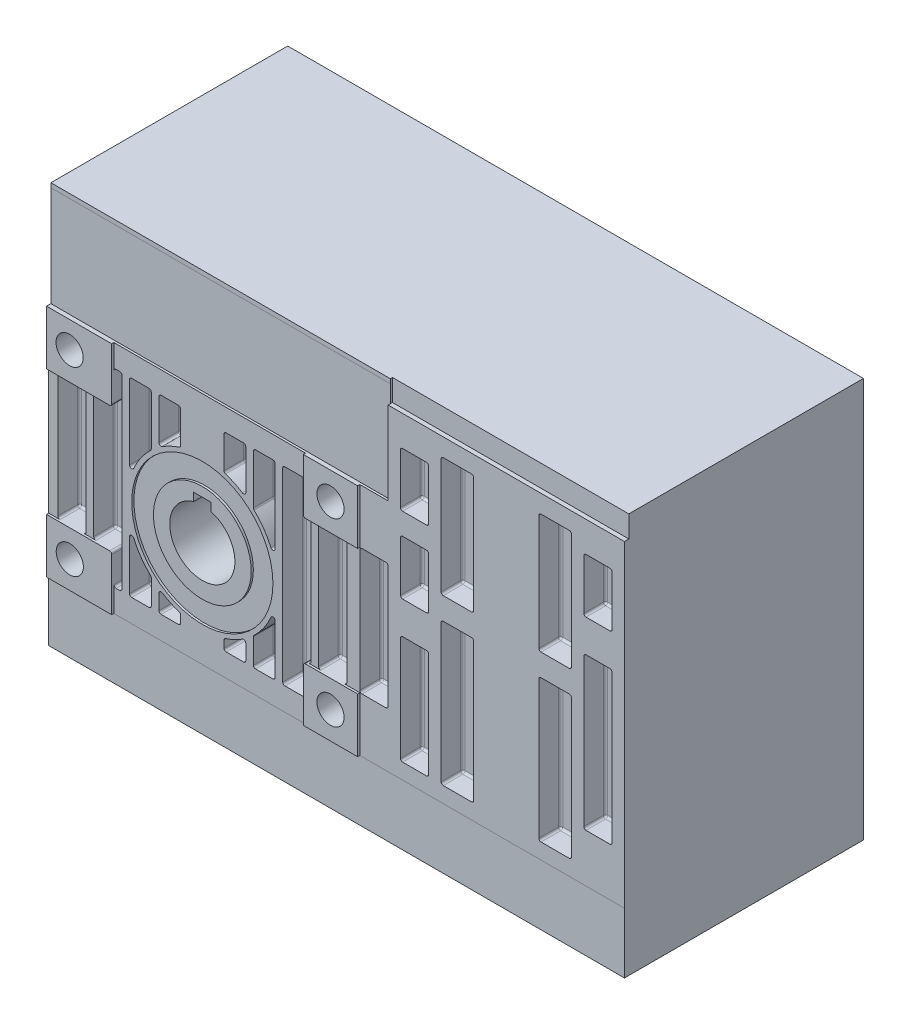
SolidWorks part; units mm, degrees
ref_plane "Plan de face" through (0, 0, 0) normal (0, 0, 1) x (1, 0, 0)
ref_plane "Plan de dessus" through (0, 0, 0) normal (0, 1, 0) x (1, 0, 0)
ref_plane "Plan de droite" through (0, 0, 0) normal (1, 0, 0) x (0, 0, -1)
sketch "Esquisse1" plane through (0, 0, 0) normal (0, 0, 1) x (1, 0, 0)
  line L0 (-132.5, 92) -> (132.5, -92) construction
  line L1 (-132.5, 92) -> (132.5, 92)
  line L2 (-132.5, 92) -> (-132.5, -92)
  line L3 (-132.5, -92) -> (132.5, -92)
  line L4 (132.5, 92) -> (132.5, -92)
  dimension "D1" = 265
  dimension "D2" = 184
extrude "Extrusion1" add sketch "Esquisse1" along normal mid plane 110
sketch "Esquisse2" plane through (0, 0, 0) normal (0, 0, 1) x (1, 0, 0)
  line L0 (-132.5, -92) -> (132.5, -92) construction
  line L1 (-132.5, 92) -> (-132.5, -92) construction
  line L2 (-61.8, -36.8193) -> (-61.8, 14.4551) construction
  line L3 (-65.8, 2.5) -> (-57.8, 2.5)
  line L4 (-65.8, 2.5) -> (-65.8, -1.2432)
  line L6 (-57.8, 2.5) -> (-57.8, -1.2432)
  arc A0 (-65.8, -1.2432) -> (-57.8, -1.2432) centre (-61.8, -15.7) ccw
  dimension "D3" = 30
  dimension "D1" = 76.3
  dimension "D2" = 70.7
  dimension "D4" = 8
  dimension "D5" = 18.2
extrude "Enlèv. mat.-Extru.1" cut sketch "Esquisse2" against normal mid plane 110
sketch "Esquisse3" plane through (0, 0, 55) normal (0, 0, 1) x (1, 0, 0)
  line L0 (-61.8, -48.9025) -> (-61.8, 32.4301) construction
  line L1 (-31.9153, -15.7) -> (-94.3732, -15.7) construction
  line L2 (-61.8, -36.8193) -> (-61.8, 14.4551) construction
  arc A0 (-65.8, -1.2432) -> (-57.8, -1.2432) centre (-61.8, -15.7) ccw construction
  point P0 (-121.8, 31.3)
  point P6 (-1.8, 31.3)
  point P9 (-121.8, -51.7)
  point P10 (-1.8, -51.7)
  dimension "D2" = 47
  dimension "D3" = 83
  dimension "D1" = 60
  dimension "D4" = 60
sketch "Esquisse5" plane through (0, 0, 55) normal (0, 0, 1) x (1, 0, 0)
  line L0 (-14.3, 43.8) -> (10.7, 18.8) construction
  line L1 (-14.3, 43.8) -> (10.7, 43.8)
  line L2 (-14.3, 43.8) -> (-14.3, 18.8)
  line L3 (-14.3, 18.8) -> (10.7, 18.8)
  line L4 (10.7, 43.8) -> (10.7, 18.8)
  line L5 (-106.3299, -51.7) -> (-137.2701, -51.7) construction
  line L6 (-14.3, -39.2) -> (10.7, -64.2) construction
  line L7 (-14.3, -39.2) -> (10.7, -39.2)
  line L8 (-14.3, -39.2) -> (-14.3, -64.2)
  line L9 (-14.3, -64.2) -> (10.7, -64.2)
  line L10 (10.7, -39.2) -> (10.7, -64.2)
  line L11 (-106.3299, 31.3) -> (-137.2701, 31.3) construction
  line L12 (-132.5, 43.8) -> (-102.5, 43.8)
  line L13 (-132.5, 43.8) -> (-132.5, 18.8)
  line L14 (-132.5, 18.8) -> (-102.5, 18.8)
  line L15 (-102.5, 43.8) -> (-102.5, 18.8)
  line L16 (-132.5, 92) -> (-132.5, -92) construction
  line L18 (-132.5, -64.2) -> (-102.5, -64.2)
  line L19 (-132.5, -64.2) -> (-132.5, -39.2)
  line L20 (-132.5, -39.2) -> (-102.5, -39.2)
  line L21 (-102.5, -64.2) -> (-102.5, -39.2)
  dimension "D1" = 25
  dimension "D2" = 25
  dimension "D3" = 25
  dimension "D4" = 25
  dimension "D5" = 30
  dimension "D6" = 25
  dimension "D7" = 25
  dimension "D8" = 30
extrude "Extrusion2" add sketch "Esquisse5" along normal blind 1
hole_wizard "Trou taraudé M14x1.57" positions "Esquisse11" profile "Esquisse10" tap size "M14x1.5" standard "ISO"
sketch "Esquisse11" plane through (0, 0, 56) normal (0, 0, 1) x (1, 0, 0)
  point P1 (-121.8821, 31.6362)
  point P5 (-1.8, 31.3)
  point P8 (-1.8, -51.7)
  point P11 (-121.8, -51.7)
sketch "Esquisse10" plane through (-121.8821, 31.6362, 56) normal (1, 0, 0) x (0, -1, 0)
  line L0 (0, 0) -> (0, 26.2554)
  line L1 (0, 26.2554) -> (6.25, 22.5)
  line L2 (6.25, 22.5) -> (6.25, 0)
  line L5 (6.25, 0) -> (0, 0)
  line L10 (0, 26.2554) -> (-6.25, 22.5) construction
  line L11 (0, -6.35) -> (0, 107.95) construction
  dimension "Diamètre du trou pour taraudage" = 12.5
  dimension "Profondeur du trou pour taraudage" = 22.5
  dimension "Angle de pointe" = 118
sketch "Esquisse12" plane through (0, 0, 55) normal (0, 0, 1) x (1, 0, 0)
  circle A0 centre (-61.8, -15.7) radius 32.5
  circle A1 centre (-61.8, -15.7) radius 22.5
  dimension "D1" = 45
  dimension "D2" = 65
extrude "Enlèv. mat.-Extru.2" cut sketch "Esquisse12" against normal blind 1
sketch "Esquisse13" plane through (0, 0, 55) normal (0, 0, 1) x (1, 0, 0)
  line L0 (-103.9821, -15.7) -> (-20.5905, -15.7) construction
  line L1 (-81.8, 33.6362) -> (-71.8, 33.6362)
  line L2 (-81.8, 33.6362) -> (-81.8, 12.4114)
  line L3 (-95.3, 33.6362) -> (-85.3, 33.6362)
  line L4 (-71.8, 33.6362) -> (-71.8, 17.3189)
  line L5 (-85.3, 33.6362) -> (-85.3, 9.5587)
  line L6 (-71.8, -53.7) -> (-71.8, -48.7189)
  line L7 (-95.3, 33.6362) -> (-95.3, -7.4538)
  line L8 (-95.3, -53.7) -> (-85.3, -53.7)
  line L9 (-81.8, -53.7) -> (-81.8, -43.8114)
  line L10 (-85.3, -53.7) -> (-85.3, -40.9587)
  line L11 (-81.8, -53.7) -> (-71.8, -53.7)
  line L12 (-95.3, -53.7) -> (-95.3, -23.9462)
  line L13 (10.7, -39.2) -> (23.7, -39.2)
  line L14 (-61.8, -15.7) -> (-61.8, 40.066) construction
  line L15 (-8.3, -39.2) -> (4.7, -39.2)
  line L16 (-28.3, -53.7) -> (-28.3, -23.9462)
  line L17 (-51.8, -53.7) -> (-41.8, -53.7)
  line L18 (-38.3, -53.7) -> (-38.3, -40.9587)
  line L19 (-41.8, -53.7) -> (-41.8, -43.8114)
  line L20 (-38.3, -53.7) -> (-28.3, -53.7)
  line L21 (-28.3, 33.6362) -> (-28.3, -7.4538)
  line L22 (-51.8, -53.7) -> (-51.8, -48.7189)
  line L23 (-38.3, 33.6362) -> (-38.3, 9.5587)
  line L24 (-51.8, 33.6362) -> (-51.8, 17.3189)
  line L25 (-38.3, 33.6362) -> (-28.3, 33.6362)
  line L26 (-41.8, 33.6362) -> (-41.8, 12.4114)
  line L27 (-51.8, 33.6362) -> (-41.8, 33.6362)
  line L28 (10.7, 18.8) -> (23.7, 18.8)
  line L29 (-102.5, 33.6362) -> (-98.8, 33.6362)
  line L30 (-98.8, 33.6362) -> (-98.8, -53.7)
  line L31 (-102.5, -53.7) -> (-98.8, -53.7)
  line L32 (-111.8, 18.8) -> (-111.8, -39.2)
  line L33 (-128.3, 18.8) -> (-128.3, -39.2)
  line L34 (-8.3, 18.8) -> (4.7, 18.8)
  line L35 (-128.3, 18.8) -> (-115.3, 18.8)
  line L36 (-128.3, -39.2) -> (-115.3, -39.2)
  line L37 (-111.8, -39.2) -> (-102.5, -39.2)
  line L38 (-14.3, -39.2) -> (-11.8, -39.2)
  line L39 (-102.5, -53.7) -> (-102.5, -39.2)
  line L40 (-24.8, 33.6362) -> (-14.3, 33.6362)
  line L41 (-111.8, 18.8) -> (-102.5, 18.8)
  line L42 (-14.3, 33.6362) -> (-14.3, 18.8)
  line L43 (-14.3, -53.7) -> (-14.3, -39.2)
  line L44 (-115.3, 18.8) -> (-115.3, -39.2)
  line L45 (-24.8, 33.6362) -> (-24.8, -53.7)
  line L46 (-24.8, -53.7) -> (-14.3, -53.7)
  line L47 (-11.8, 18.8) -> (-11.8, -39.2)
  line L48 (-102.5, 18.8) -> (-102.5, 33.6362)
  line L49 (-8.3, 18.8) -> (-8.3, -39.2)
  line L50 (-14.3, 18.8) -> (-11.8, 18.8)
  line L51 (4.7, 18.8) -> (4.7, -39.2)
  line L52 (48.1, 73.7167) -> (63.1, 73.7167)
  line L53 (48.1, -57) -> (48.1, 8.5025)
  line L54 (48.1, 18.7167) -> (63.1, 18.7167)
  line L55 (48.1, 8.5025) -> (63.1, 8.5025)
  line L56 (63.1, 8.5025) -> (63.1, -57)
  line L57 (29.4, 8) -> (42.4, 8)
  line L59 (29.4, -57) -> (42.4, -57)
  line L60 (48.1, -57) -> (63.1, -57)
  line L61 (78.1, 107.9884) -> (78.1, -114.435) construction
  line L62 (93.1, -57) -> (93.1, 8.5025)
  line L63 (10.7, 18.8) -> (10.7, -39.2)
  line L64 (108.1, -57) -> (108.1, 8.5025)
  line L65 (23.7, 18.8) -> (23.7, -39.2)
  line L66 (132.5, -92) -> (132.5, 92) construction
  line L68 (42.4, -57) -> (42.4, -7)
  line L69 (48.1, 73.7167) -> (48.1, 18.7167)
  line L70 (42.4, 8) -> (42.4, 33)
  line L71 (63.1, 73.7167) -> (63.1, 18.7167)
  line L72 (-132.5, -92) -> (132.5, -92) construction
  line L73 (29.4, -57) -> (29.4, -7)
  line L74 (29.4, 8) -> (29.4, 33)
  line L75 (113.8, -42) -> (113.8, 28)
  line L76 (126.8, -42) -> (126.8, 28)
  line L77 (108.1, -57) -> (93.1, -57)
  line L80 (108.1, 8.5025) -> (93.1, 8.5025)
  line L81 (108.1, 18.7167) -> (93.1, 18.7167)
  line L82 (93.1, 73.7167) -> (93.1, 18.7167)
  line L83 (108.1, 73.7167) -> (108.1, 18.7167)
  line L84 (108.1, 73.7167) -> (93.1, 73.7167)
  line L88 (42.4, -7) -> (29.4, -7)
  line L92 (42.4, 33) -> (29.4, 33)
  line L94 (29.4, 43) -> (42.4, 43)
  line L95 (29.4, 43) -> (29.4, 68)
  line L96 (29.4, 68) -> (42.4, 68)
  line L97 (42.4, 43) -> (42.4, 68)
  line L98 (113.8, 28) -> (126.8, 28)
  line L100 (113.8, -42) -> (126.8, -42)
  line L102 (126.8, 68) -> (113.8, 68)
  line L103 (126.8, 68) -> (126.8, 43)
  line L104 (126.8, 43) -> (113.8, 43)
  line L105 (113.8, 68) -> (113.8, 43)
  arc A0 (-71.8, 17.3189) -> (-81.8, 12.4114) centre (-61.8, -15.7) ccw
  arc A1 (-28.3, -7.4538) -> (-38.3, 9.5587) centre (-61.8, -15.7) ccw
  circle A2 centre (-61.8, -15.7) radius 34.5
  arc A3 (-85.3, 9.5587) -> (-95.3, -7.4538) centre (-61.8, -15.7) ccw
  arc A4 (-81.8, -43.8114) -> (-71.8, -48.7189) centre (-61.8, -15.7) ccw
  arc A5 (-51.8, -48.7189) -> (-41.8, -43.8114) centre (-61.8, -15.7) ccw
  arc A6 (-38.3, -40.9587) -> (-28.3, -23.9462) centre (-61.8, -15.7) ccw
  arc A7 (-41.8, 12.4114) -> (-51.8, 17.3189) centre (-61.8, -15.7) ccw
  arc A8 (-95.3, -23.9462) -> (-85.3, -40.9587) centre (-61.8, -15.7) ccw
  dimension "D7" = 50
  dimension "D2" = 10
  dimension "D4" = 10
  dimension "D5" = 10
  dimension "D6" = 3.5
  dimension "D8" = 15
  dimension "D10" = 13
  dimension "D11" = 3.5
  dimension "D12" = 3.5
  dimension "D14" = 13
  dimension "D15" = 13
  dimension "D16" = 3.5
  dimension "D17" = 3.5
  dimension "D18" = 13
  dimension "D20" = 15
  dimension "D22" = 15
  dimension "D23" = 55
  dimension "D24" = 13
  dimension "D28" = 10
  dimension "D29" = 25
  dimension "D30" = 25
  dimension "D31" = 13
  dimension "D33" = 50
  dimension "D34" = 70
  dimension "D35" = 25
  dimension "D36" = 13
  dimension "D37" = 5.7
  dimension "D38" = 15
  dimension "D1" = 2
extrude "Enlèv. mat.-Extru.3" cut sketch "Esquisse13" against normal blind 10
fillet "Congé1" radius 1 54 edges at (-76.9994, -46.6714, 45) (-81.8, -53.7, 50) (-71.8, -48.7189, 50) (-81.8, -43.8114, 50) (-81.8, -48.7557, 45) (-71.8, -53.7, 50) (-76.8, -53.7, 45) (-71.8, -51.2095, 45) (-85.3, -53.7, 50) (-90.3, -53.7, 45) (-95.3, -53.7, 50) (-85.3, -47.3293, 45) (-85.3, -40.9587, 50) (-95.3, -38.8231, 45) (-91.5423, -33.1827, 45) (-95.3, -23.9462, 50) (-71.8, 17.3189, 50) (-81.8, 33.6362, 50) (-71.8, 33.6362, 50) (-71.8, 25.4776, 45) (-76.8, 33.6362, 45) (-76.9994, 15.2714, 45) (-81.8, 23.0238, 45) (-81.8, 12.4114, 50) (-95.3, -7.4538, 50) (-85.3, 9.5587, 50) (-85.3, 33.6362, 50) (-95.3, 33.6362, 50) (-98.8, -53.7, 50) (-102.5, -53.7, 50) (-98.8, 33.6362, 50) (-102.5, 33.6362, 50) (-91.5423, 1.7827, 45) (-85.3, 21.5974, 45) (-95.3, 13.0912, 45) (-90.3, 33.6362, 45) (-100.65, 33.6362, 45) (-98.8, -10.0319, 45) (-100.65, -53.7, 45) (-102.5, -46.45, 45) (-107.15, -39.2, 45) (-111.8, -39.2, 50) (-102.5, 26.2181, 45) (-107.15, 18.8, 45) (-111.8, -10.2, 45) (-111.8, 18.8, 50) (-115.3, 18.8, 50) (-115.3, -10.2, 45) (-115.3, -39.2, 50) (-121.8, -39.2, 45) (-128.3, -10.2, 45) (-121.8, 18.8, 45) (-128.3, 18.8, 50) (-128.3, -39.2, 50)
fillet "Congé3" radius 1 140 edges at (-28.3, -7.4538, 50) (-32.0577, 1.7827, 45) (-38.3, 9.5587, 50) (-46.6006, 15.2714, 45) (-51.8, 17.3189, 50) (29.4, 8, 50) (29.4, 43, 50) (48.1, 18.7167, 50) (93.1, 18.7167, 50) (113.8, 43, 50) (108.1, 8.5025, 50) (126.8, 28, 50) (108.1, 73.7167, 50) (126.8, 68, 50) (42.4, -7, 50) (63.1, 8.5025, 50) (63.1, 73.7167, 50) (42.4, 68, 50) (42.4, 33, 50) (23.7, 18.8, 50) (4.7, 18.8, 50) (-14.3, 18.8, 50.5) (-41.8, 33.6362, 50) (-41.8, 23.0238, 45) (-28.3, 13.0912, 45) (-28.3, 33.6362, 50) (-11.8, 18.8, 50) (-14.3, 33.6362, 50) (-14.3, 26.2181, 45) (-13.05, 18.8, 45) (-28.3, -23.9462, 50) (-41.8, -43.8114, 50) (-51.8, -48.7189, 50) (-46.6006, -46.6714, 45) (-38.3, -40.9587, 50) (-32.0577, -33.1827, 45) (-38.3, -47.3293, 45) (-51.8, -51.2095, 45) (-51.8, -53.7, 50) (-38.3, -53.7, 50) (-24.8, -53.7, 50) (-8.3, -39.2, 50) (10.7, -39.2, 50) (29.4, -57, 50) (48.1, -57, 50) (93.1, -57, 50) (113.8, -42, 50) (-46.8, -53.7, 45) (-41.8, -48.7557, 45) (-41.8, -53.7, 50) (-33.3, -53.7, 45) (-28.3, -38.8231, 45) (-28.3, -53.7, 50) (-13.05, -39.2, 45) (-11.8, -10.2, 45) (-11.8, -39.2, 50) (-14.3, -46.45, 45) (-14.3, -53.7, 50) (-19.55, -53.7, 45) (4.7, -10.2, 45) (4.7, -39.2, 50) (-1.8, -39.2, 45) (23.7, -39.2, 50) (17.2, -39.2, 45) (23.7, -10.2, 45) (35.9, 8, 45) (42.4, 8, 50) (42.4, 20.5, 45) (35.9, 43, 45) (42.4, 55.5, 45) (42.4, 43, 50) (63.1, 18.7167, 50) (55.6, 18.7167, 45) (63.1, 46.2167, 45) (108.1, 18.7167, 50) (100.6, 18.7167, 45) (108.1, 46.2167, 45) (126.8, 55.5, 45) (120.3, 43, 45) (126.8, 43, 50) (42.4, -32, 45) (42.4, -57, 50) (35.9, -57, 45) (63.1, -24.2487, 45) (63.1, -57, 50) (55.6, -57, 45) (100.6, -57, 45) (108.1, -24.2487, 45) (108.1, -57, 50) (120.3, -42, 45) (126.8, -7, 45) (126.8, -42, 50) (29.4, -32, 45) (29.4, -7, 50) (35.9, -7, 45) (48.1, -24.2487, 45) (48.1, 8.5025, 50) (55.6, 8.5025, 45) (93.1, -24.2487, 45) (93.1, 8.5025, 50) (100.6, 8.5025, 45) (113.8, -7, 45) (113.8, 28, 50) (120.3, 28, 45) (93.1, 73.7167, 50) (93.1, 46.2167, 45) (100.6, 73.7167, 45) (113.8, 68, 50) (113.8, 55.5, 45) (120.3, 68, 45) (48.1, 73.7167, 50) (55.6, 73.7167, 45) (48.1, 46.2167, 45) (35.9, 68, 45) (29.4, 55.5, 45) (29.4, 68, 50) (29.4, 20.5, 45) (29.4, 33, 50) (35.9, 33, 45) (10.7, -10.2, 45) (17.2, 18.8, 45) (10.7, 18.8, 50) (-8.3, -10.2, 45) (-1.8, 18.8, 45) (-8.3, 18.8, 50) (-24.8, 33.6362, 50) (-19.55, 33.6362, 45) (-24.8, -10.0319, 45) (-33.3, 33.6362, 45) (-38.3, 21.5974, 45) (-38.3, 33.6362, 50) (-51.8, 25.4776, 45) (-46.8, 33.6362, 45) (-51.8, 33.6362, 50) (-102.2071, 18.5071, 45.2929) (-102.2071, -38.9071, 45.2929) (-102.5, 18.8, 51) (-102.5, -39.2, 51) (-14.3, -39.2, 50.5) (-41.8, 12.4114, 50)
sketch "Esquisse14" plane through (0, 0, 55) normal (0, 0, 1) x (1, 0, 0)
  line L0 (-102.5, 43.8) -> (-132.5, 43.8) construction
  line L5 (-132.5, 92) -> (23.7, 92)
  line L6 (-132.5, 92) -> (-132.5, 43.8)
  line L7 (-132.5, 43.8) -> (23.7, 43.8)
  line L8 (23.7, 92) -> (23.7, 43.8)
  line L9 (23.7, -38.2) -> (23.7, 17.8) construction
extrude "Enlèv. mat.-Extru.4" cut sketch "Esquisse14" against normal blind 1
ref_plane "Plan2" through (0, -64.2, 0) normal (0, 1, 0) x (-1, 0, 0)
ref_plane "Plan3" through (0, 90, 0) normal (0, 1, 0) x (-1, 0, 0)
sketch "Esquisse15" plane through (0, 0, 55) normal (0, 0, 1) x (1, 0, 0)
  line L0 (23.7, 43.8) -> (23.7, 92) construction
  line L1 (132.5, 92) -> (23.7, 92)
  line L2 (132.5, 92) -> (132.5, 82)
  line L3 (132.5, 82) -> (23.7, 82)
  line L4 (23.7, 92) -> (23.7, 82)
  dimension "D1" = 10
extrude "Enlèv. mat.-Extru.5" cut sketch "Esquisse15" against normal blind 2
